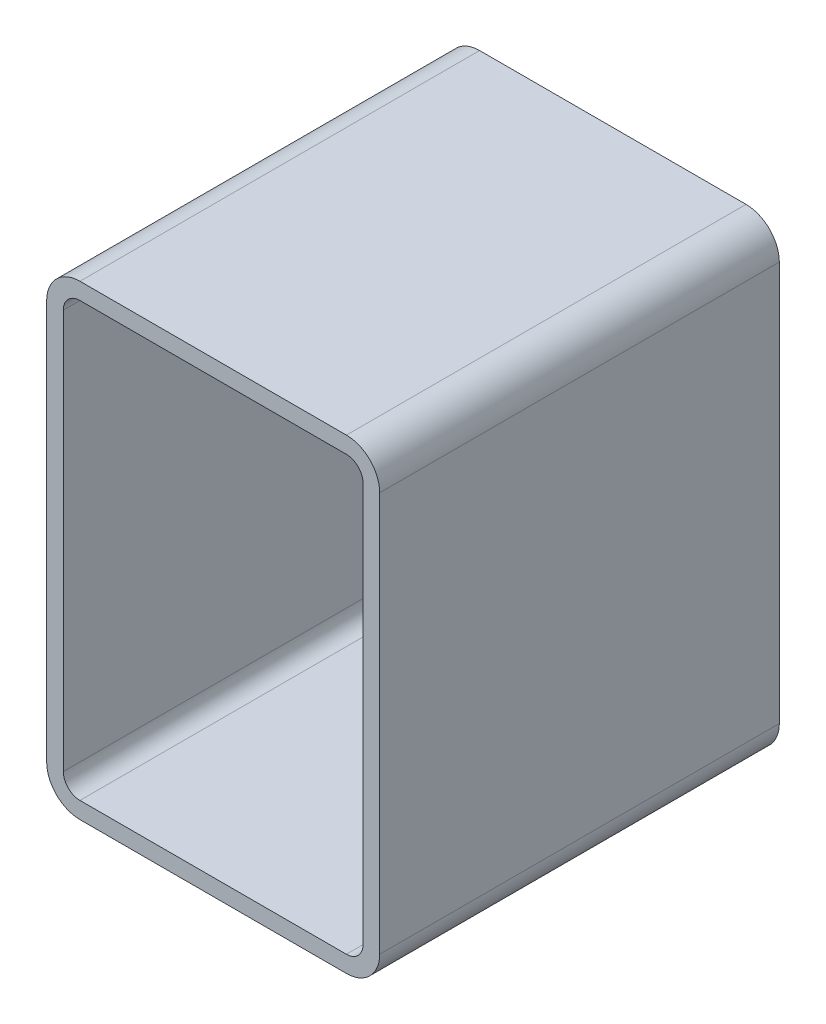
SolidWorks part; units mm, degrees
ref_plane "Front Plane" through (0, 0, 0) normal (0, 0, 1) x (1, 0, 0)
ref_plane "Top Plane" through (0, 0, 0) normal (0, 1, 0) x (1, 0, 0)
ref_plane "Right Plane" through (0, 0, 0) normal (1, 0, 0) x (0, 0, -1)
sketch "Sketch1" plane through (0, 0, 0) normal (0, 0, 1) x (1, 0, 0)
sketch_block_instance "HSS14x10x0.500-1"
sketch_block "HSS14x10x0.500"
extrude "Boss-Extrude1" add sketch "Sketch1" along normal blind 304.8
